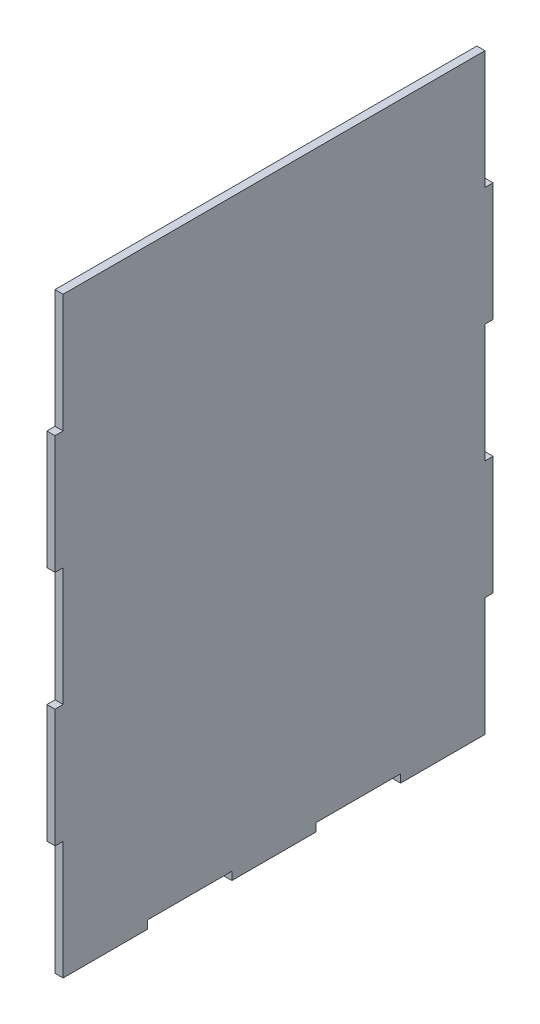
SolidWorks part; units mm, degrees
ref_plane "Front Plane" through (0, 0, 0) normal (0, 0, 1) x (1, 0, 0)
ref_plane "Top Plane" through (0, 0, 0) normal (0, 1, 0) x (1, 0, 0)
ref_plane "Right Plane" through (0, 0, 0) normal (1, 0, 0) x (0, 0, -1)
ref_plane "Plane1" through (3.175, 0, 0) normal (1, 0, 0) x (0, 0, -1)
sketch "Sketch1" plane through (3.175, 0, 0) normal (1, 0, 0) x (0, 0, -1)
  line L0 (168.275, -46.355) -> (168.275, 0)
  line L1 (168.275, 0) -> (3.175, 0)
  line L2 (3.175, 0) -> (3.175, -46.355)
  line L3 (3.175, -46.355) -> (0, -46.355)
  line L4 (0, -46.355) -> (0, -92.71)
  line L5 (0, -92.71) -> (3.175, -92.71)
  line L6 (3.175, -92.71) -> (3.175, -139.065)
  line L7 (3.175, -139.065) -> (0, -139.065)
  line L8 (0, -139.065) -> (0, -185.42)
  line L9 (0, -185.42) -> (3.175, -185.42)
  line L10 (3.175, -185.42) -> (3.175, -231.775)
  line L11 (3.175, -231.775) -> (36.195, -231.775)
  line L12 (36.195, -231.775) -> (36.195, -228.6)
  line L13 (36.195, -228.6) -> (69.215, -228.6)
  line L14 (69.215, -228.6) -> (69.215, -231.775)
  line L15 (69.215, -231.775) -> (102.235, -231.775)
  line L16 (102.235, -231.775) -> (102.235, -228.6)
  line L17 (102.235, -228.6) -> (135.255, -228.6)
  line L18 (135.255, -228.6) -> (135.255, -231.775)
  line L19 (135.255, -231.775) -> (168.275, -231.775)
  line L20 (168.275, -231.775) -> (168.275, -185.42)
  line L21 (168.275, -185.42) -> (171.45, -185.42)
  line L22 (171.45, -185.42) -> (171.45, -139.065)
  line L23 (171.45, -139.065) -> (168.275, -139.065)
  line L24 (168.275, -139.065) -> (168.275, -92.71)
  line L25 (168.275, -92.71) -> (171.45, -92.71)
  line L26 (171.45, -92.71) -> (171.45, -46.355)
  line L27 (171.45, -46.355) -> (168.275, -46.355)
  dimension "D1" = 3.175
  dimension "D2" = 36.195
  dimension "D3" = 69.215
  dimension "D4" = 102.235
  dimension "D5" = 135.255
  dimension "D6" = 168.275
  dimension "D7" = 171.45
  dimension "D8" = 3.175
  dimension "D9" = 46.355
  dimension "D10" = 92.71
  dimension "D11" = 139.065
  dimension "D12" = 185.42
  dimension "D13" = 231.775
extrude "Boss-Extrude1" add sketch "Sketch1" against normal blind 3.175
